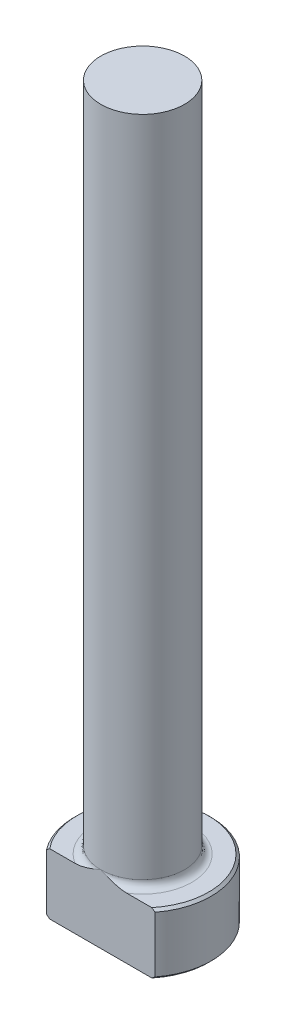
SolidWorks part; units mm, degrees
ref_plane "Front Plane" through (0, 0, 0) normal (0, 0, 1) x (1, 0, 0)
ref_plane "Top Plane" through (0, 0, 0) normal (0, 1, 0) x (1, 0, 0)
ref_plane "Right Plane" through (0, 0, 0) normal (1, 0, 0) x (0, 0, -1)
sketch "Sketch1" plane through (0, 0, 0) normal (0, 0, 1) x (1, 0, 0)
  line L0 (0, 259.9588) -> (0, -15.1925) construction
  line L1 (0, 0) -> (-7.1374, 0)
  line L2 (-7.1374, 0) -> (-7.1374, 6.35)
  line L3 (-7.1374, 6.35) -> (-4.365, 6.35)
  line L4 (-4.365, 6.35) -> (-4.365, 76.2)
  line L5 (-4.365, 76.2) -> (0, 76.2)
  line L6 (0, 76.2) -> (0, 0)
  dimension "L" = 76.2
  dimension "H" = 14.2748
  dimension "T" = 6.35
  dimension "D" = 8.73
revolve "Revolve1" add sketch "Sketch1" angle 360 about L0
chamfer "Chamfer1" distance 0.254 angle 45 2 edges at (0, 6.35, 7.1374) (0, 0, 7.1374)
fillet "Fillet1" radius 0.762 1 edges at (0, 6.35, 4.365)
sketch "Sketch2" plane through (0, 0, 0) normal (0, 1, 0) x (1, 0, 0)
  line L0 (-5.6471, -4.365) -> (5.6471, -4.365)
  circle A0 centre (0, 0) radius 7.1374 construction
  arc A1 (-5.6471, -4.365) -> (5.6471, -4.365) centre (0, 0) ccw
  circle A3 centre (0, 0) radius 4.365 construction
  dimension "D1" = 0
extrude "Key" cut sketch "Sketch2" along normal through all
sketch "Pocket Sketch" plane through (0, 0, 0) normal (0, 0, 1) x (1, 0, 0)
  line L0 (-7.5343, 0) -> (-7.5343, 6.3754)
  line L1 (-7.5343, 6.3754) -> (-5.5239, 6.3754)
  line L2 (-4.7619, 7.1374) -> (-4.7619, 22.225)
  line L3 (-4.7619, 22.225) -> (0, 22.225)
  line L4 (0, 22.225) -> (0, 0)
  line L5 (0, 0) -> (-7.5343, 0)
  line L6 (0, 12.6104) -> (0, -2.4989) construction
  line L7 (-7.1374, 6.096) -> (-7.1374, 0.254) construction
  line L8 (6.8834, 6.35) -> (-6.8834, 6.35) construction
  line L9 (-4.365, 76.2) -> (-4.365, 7.112) construction
  line L10 (-5.5239, 6.3754) -> (-4.7619, 7.1374)
  point P3 (-4.7619, 6.3754)
  dimension "D1" = 15.0685
  dimension "D2" = 0.3969
  dimension "D3" = 0.0254
  dimension "D4" = 0.3969
  dimension "D5" = 9.5237
  dimension "D6" = 22.225
